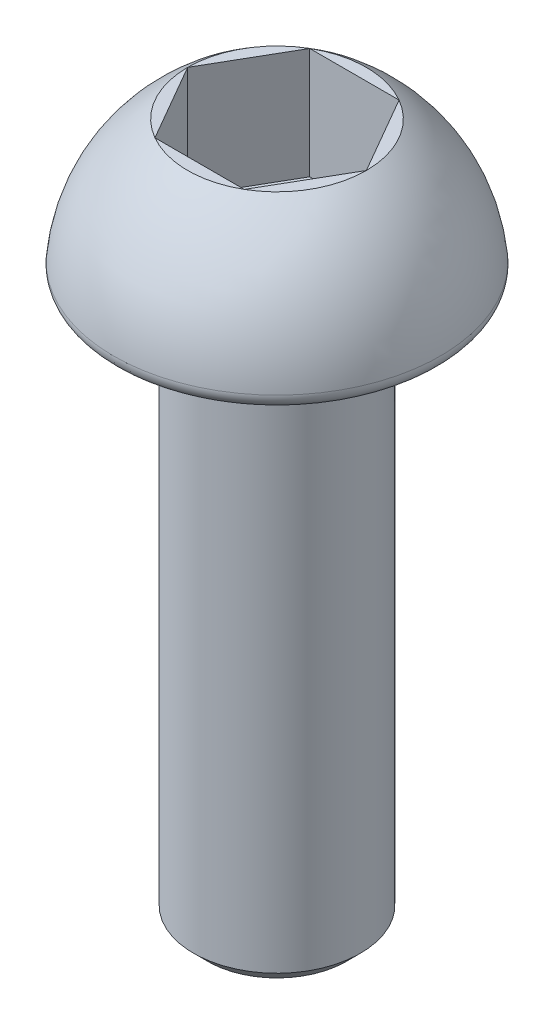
SolidWorks part; units mm, degrees
ref_plane "Plan1" through (0, 0, 0) normal (0, 0, 1) x (1, 0, 0)
ref_plane "Plan2" through (0, 0, 0) normal (0, 1, 0) x (1, 0, 0)
ref_plane "Plan3" through (0, 0, 0) normal (1, 0, 0) x (0, 0, -1)
sketch "Esquisse2" plane through (0, 0, 0) normal (0, 0, 1) x (1, 0, 0)
  line L0 (0, 0) -> (0, 80) construction
  line L1 (5.3756, 43.7086) -> (3, 43.7086)
  line L2 (3, 43.7086) -> (3, 23.7086)
  line L3 (3, 23.7086) -> (0, 23.7086)
  line L4 (3.215, 48.7086) -> (0, 48.7086)
  line L5 (0, 48.7086) -> (0, 23.7086)
  arc A0 (5.8735, 44.254) -> (3.215, 48.7086) centre (-0.1016, 43.7086) ccw
  arc A1 (5.8735, 44.254) -> (5.3756, 43.7086) centre (5.3756, 44.2086) cw
  dimension "D1" = 6
  dimension "D3" = 0.5
  dimension "D2" = 5
  dimension "D4" = 3
  dimension "D5" = 20
revolve "Base-Révolution" add sketch "Esquisse2" angle 360 about L0
sketch "Esquisse3" plane through (0, 48.7086, 0) normal (0, 1, 0) x (-1, 0, 0)
  line L0 (-3.215, 0) -> (-1.6075, 2.7843)
  line L1 (-1.6075, 2.7843) -> (1.6075, 2.7843)
  line L2 (1.6075, 2.7843) -> (3.215, 0)
  line L3 (3.215, 0) -> (1.6075, -2.7843)
  line L4 (1.6075, -2.7843) -> (-1.6075, -2.7843)
  line L5 (-1.6075, -2.7843) -> (-3.215, 0)
  point P0 (0, 0)
  point P4 (-3.215, 0)
  point P8 (-1.6075, 2.7843)
  point P9 (1.6075, 2.7843)
  point P10 (3.215, 0)
  point P11 (1.6075, -2.7843)
  point P12 (-1.6075, -2.7843)
extrude "Enlèv. mat.-Extru.1" cut sketch "Esquisse3" against normal blind 4
chamfer "Chanfrein1" distance 0.5 angle 45
